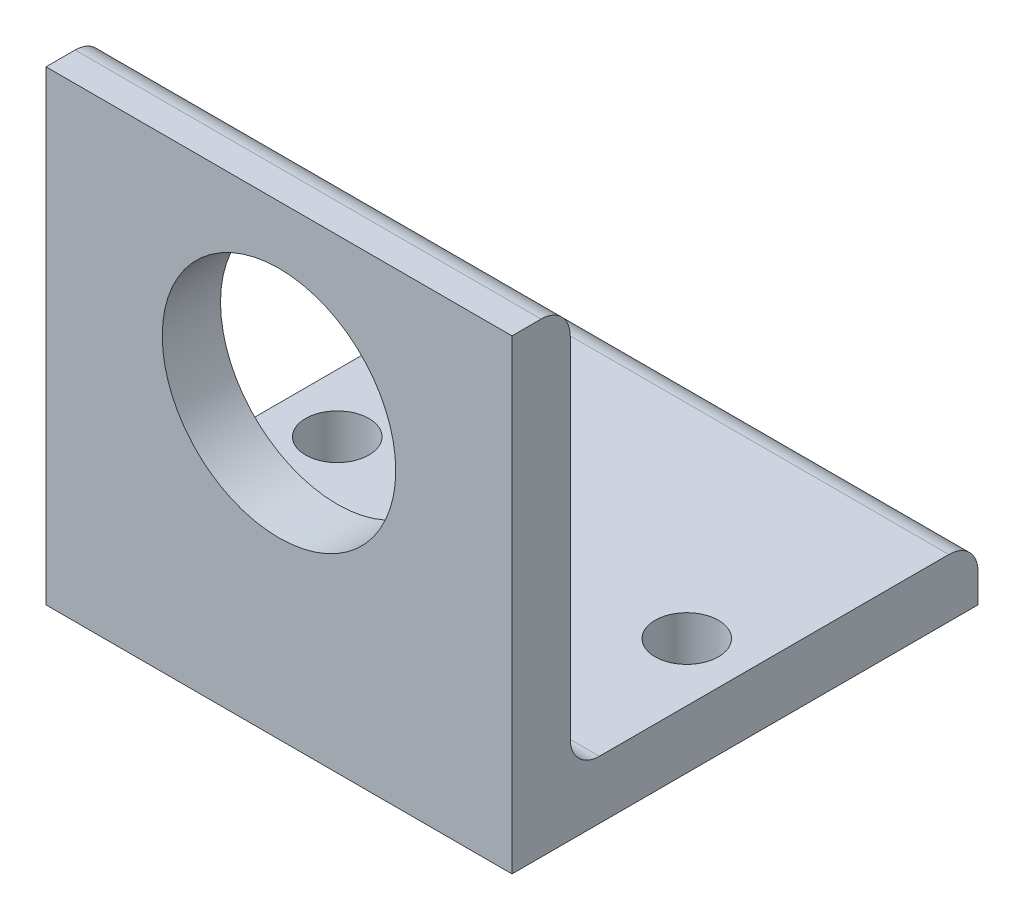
SolidWorks part; units mm, degrees
ref_plane "Front Plane" through (0, 0, 0) normal (0, 0, 1) x (1, 0, 0)
ref_plane "Top Plane" through (0, 0, 0) normal (0, 1, 0) x (1, 0, 0)
ref_plane "Right Plane" through (0, 0, 0) normal (1, 0, 0) x (0, 0, -1)
sketch "Sketch2" plane through (0, 0, 0) normal (1, 0, 0) x (0, 0, -1)
  line L0 (0, 0) -> (25.4, 0)
  line L1 (25.4, 0) -> (25.4, 3.175)
  line L2 (25.4, 3.175) -> (3.175, 3.175)
  line L3 (3.175, 3.175) -> (3.175, 25.4)
  line L4 (3.175, 25.4) -> (0, 25.4)
  line L5 (0, 25.4) -> (0, 0)
  dimension "D1" = 3.175
  dimension "D3" = 25.4
extrude "Boss-Extrude1" add sketch "Sketch2" along normal blind 25.4
sketch "Sketch3" plane through (0, 0, -3.175) normal (0, 0, -1) x (-1, 0, 0)
  line L0 (-25.4, 3.175) -> (0, 3.175) construction
  line L1 (0, 3.175) -> (0, 25.4) construction
  circle A0 centre (-12.7, 15.875) radius 6.3627
  dimension "D6" = 12.7254
  dimension "D5" = 12.7
  dimension "D7" = 12.7
extrude "Cut-Extrude1" cut sketch "Sketch3" against normal through all
sketch "Sketch4" plane through (0, 3.175, 0) normal (0, 1, 0) x (1, 0, 0)
  line L0 (0, 25.4) -> (0, 3.175) construction
  line L1 (25.4, 25.4) -> (25.4, 3.175) construction
  line L2 (25.4, 25.4) -> (0, 25.4) construction
  line L3 (3.175, 12.7) -> (22.225, 12.7) construction
  circle A1 centre (3.175, 12.7) radius 1.7272
  circle A2 centre (22.225, 12.7) radius 1.7272
  dimension "D1" = 3.175
  dimension "D3" = 3.175
  dimension "D2" = 3.4544
  dimension "D6" = 12.7
extrude "Cut-Extrude2" cut sketch "Sketch4" against normal through all
fillet "Fillet2" radius 1.5875 3 edges at (12.7, 3.175, -3.175) (12.7, 3.175, -25.4) (12.7, 25.4, -3.175)
